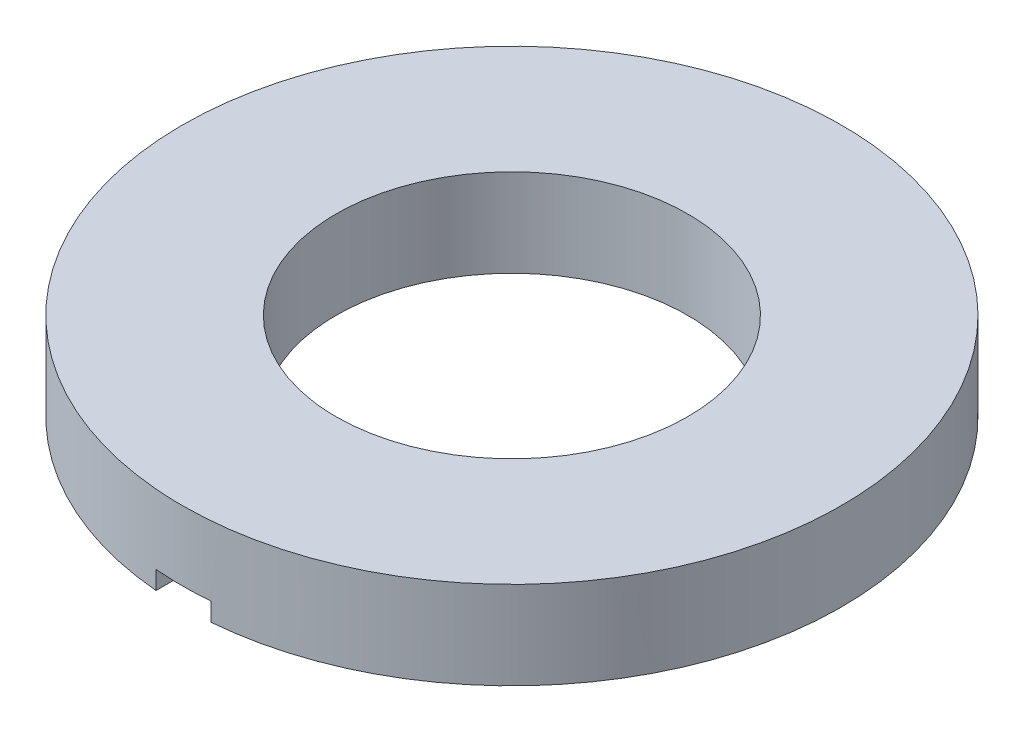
SolidWorks part; units mm, degrees
ref_plane "Front Plane" through (0, 0, 0) normal (0, 0, 1) x (1, 0, 0)
ref_plane "Top Plane" through (0, 0, 0) normal (0, 1, 0) x (1, 0, 0)
ref_plane "Right Plane" through (0, 0, 0) normal (1, 0, 0) x (0, 0, -1)
sketch "Sketch1" plane through (0, 0, 0) normal (0, 1, 0) x (1, 0, 0)
  circle A0 centre (0, 0) radius 3.2
  circle A1 centre (0, 0) radius 6
  dimension "D1" = 6.4
  dimension "D2" = 12
extrude "Extrude1" add sketch "Sketch1" along normal blind 1.6
sketch "Sketch2" plane through (0, 0, 0) normal (0, -1, 0) x (1, 0, 0)
  line L1 (-0.5, 0.4) -> (0.5, 0.4)
  line L2 (-0.5, 0.4) -> (-0.5, 6)
  line L3 (-0.5, 6) -> (0.5, 6)
  line L4 (0.5, 0.4) -> (0.5, 6)
  line L5 (-0.5, 0.4) -> (0.5, 6) construction
  line L6 (-0.5, 6) -> (0.5, 0.4) construction
  circle A0 centre (0, 0) radius 3.2 construction
  circle A1 centre (0, 0) radius 6 construction
  point P0 (0, 3.2)
  dimension "D1" = 1
extrude "Cut-Extrude1" cut sketch "Sketch2" against normal blind 0.3333
